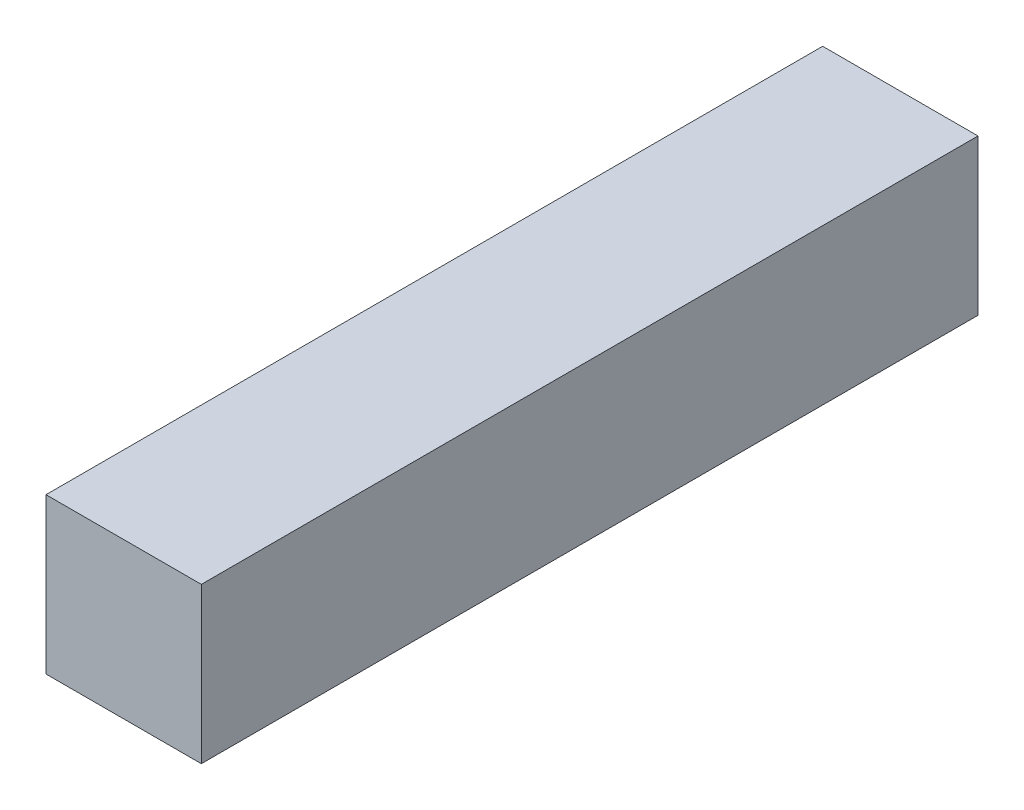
SolidWorks part; units mm, degrees
ref_plane "Front Plane" through (0, 0, 0) normal (0, 0, 1) x (1, 0, 0)
ref_plane "Top Plane" through (0, 0, 0) normal (0, 1, 0) x (1, 0, 0)
ref_plane "Right Plane" through (0, 0, 0) normal (1, 0, 0) x (0, 0, -1)
sketch "Sketch1" plane through (0, 0, 0) normal (0, 0, 1) x (1, 0, 0)
  line L1 (-10, 10) -> (10, 10)
  line L2 (-10, 10) -> (-10, -10)
  line L3 (-10, -10) -> (10, -10)
  line L4 (10, 10) -> (10, -10)
  line L5 (-10, 10) -> (10, -10) construction
  line L6 (-10, -10) -> (10, 10) construction
  point P0 (0, 0)
  dimension "Width" = 20
  dimension "Depth" = 20
extrude "Extrude1" add sketch "Sketch1" along normal mid plane 100
